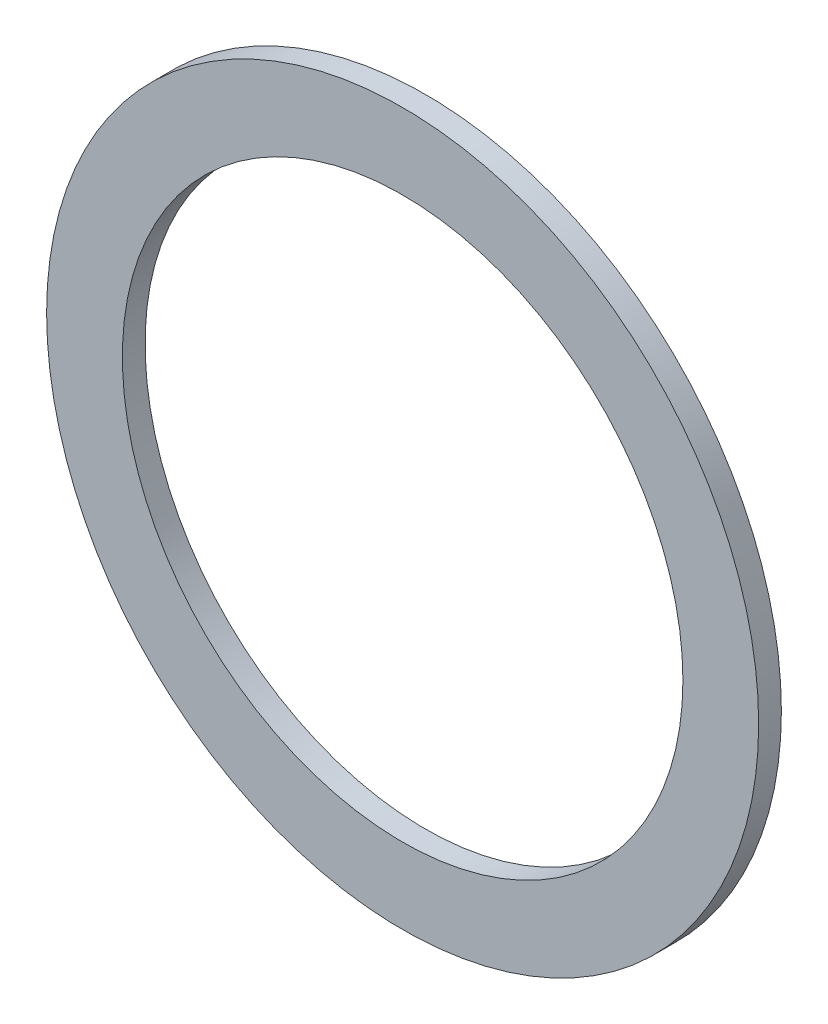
SolidWorks part; units mm, degrees
ref_plane "Face" through (0, 0, 0) normal (0, 0, 1) x (1, 0, 0)
ref_plane "Dessus" through (0, 0, 0) normal (0, 1, 0) x (1, 0, 0)
ref_plane "Droite" through (0, 0, 0) normal (1, 0, 0) x (0, 0, -1)
sketch "Esquisse1" plane through (0, 0, 0) normal (0, 0, 1) x (1, 0, 0)
  circle A0 centre (0, 0) radius 18.5
  circle A1 centre (0, 0) radius 23.5
  dimension "D1" = 37
  dimension "D2" = 47
extrude "Base-Extrusion" add sketch "Esquisse1" along normal blind 1.5
